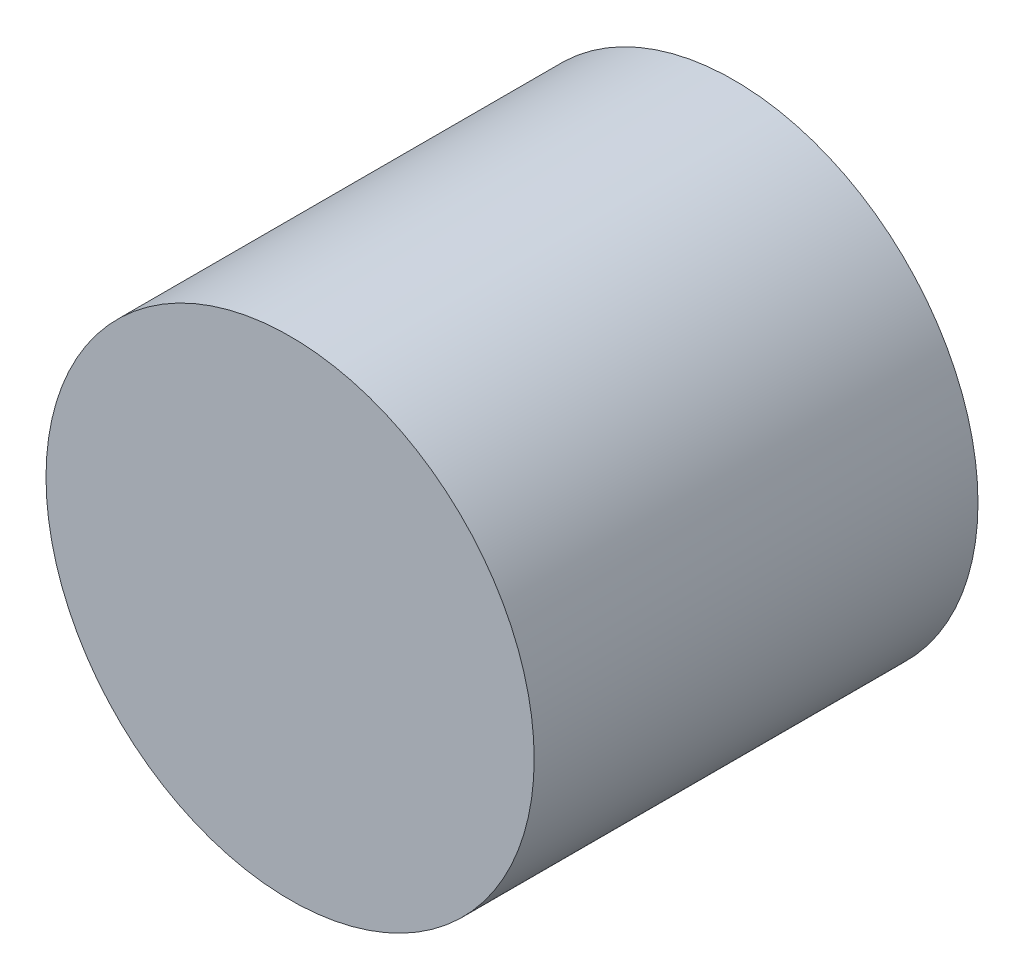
SolidWorks part; units mm, degrees
ref_plane "Plan de face" through (0, 0, 0) normal (0, 0, 1) x (1, 0, 0)
ref_plane "Plan de dessus" through (0, 0, 0) normal (0, 1, 0) x (1, 0, 0)
ref_plane "Plan de droite" through (0, 0, 0) normal (1, 0, 0) x (0, 0, -1)
sketch "Esquisse2" plane through (0, 0, -339) normal (0, 0, -1) x (-1, 0, 0)
  circle A0 centre (17.4917, -79.9906) radius 22
extrude "Extrusion1" add sketch "Esquisse2" against normal blind 40
